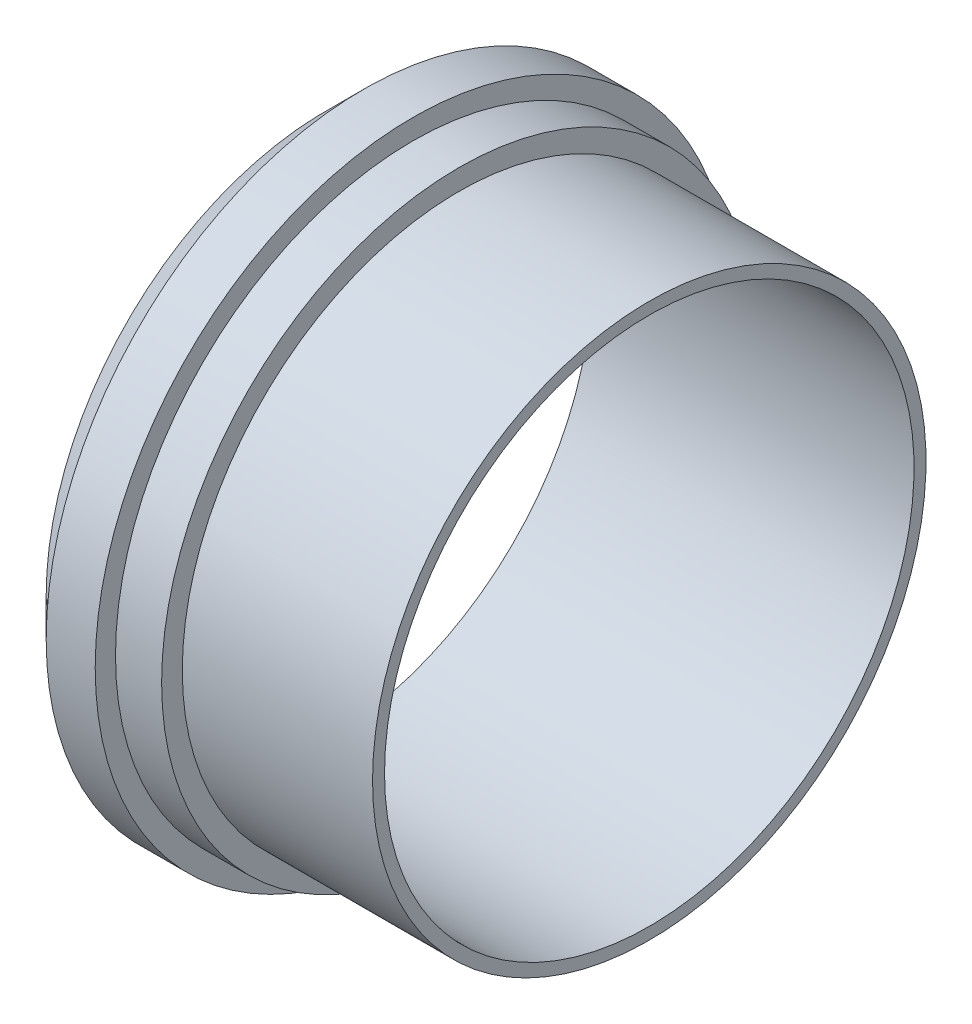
SolidWorks part; units mm, degrees
ref_plane "Front Plane" through (0, 0, 0) normal (0, 0, 1) x (1, 0, 0)
ref_plane "Top Plane" through (0, 0, 0) normal (0, 1, 0) x (1, 0, 0)
ref_plane "Right Plane" through (0, 0, 0) normal (1, 0, 0) x (0, 0, -1)
sketch "Sketch1" plane through (0, 0, 0) normal (0, 0, 1) x (1, 0, 0)
  line L0 (0, 0) -> (-26.1925, 0)
  line L1 (-26.1925, 0) -> (-26.1925, -2.8448)
  line L2 (-26.1925, -2.8448) -> (-32.5425, -2.8448)
  line L3 (-32.5425, -2.8448) -> (-32.5425, -5.6388)
  line L4 (-32.5425, -5.6388) -> (-39.2913, -5.6388)
  line L5 (-39.2913, -5.6388) -> (-44.45, -0.4826)
  line L6 (-44.45, -0.4826) -> (-44.45, 38.1)
  line L7 (-44.45, 38.1) -> (0, 38.1)
  line L8 (0, 38.1) -> (0, 0)
  dimension "D1" = 38.1
  dimension "D2" = 26.1925
  dimension "D3" = 6.35
  dimension "D4" = 6.7488
  dimension "D5" = 5.1587
  dimension "D6" = 38.5826
  dimension "D7" = 43.7388
  dimension "D8" = 40.9448
revolve "Revolve1" add sketch "Sketch1" angle 360 about L7
sketch "Sketch4" plane through (-44.45, 0, 0) normal (-1, 0, 0) x (0, 0, 1)
  circle A0 centre (0, 38.1) radius 36.449
extrude "Cut-Extrude1" cut sketch "Sketch4" against normal blind 44.45 contours A0
